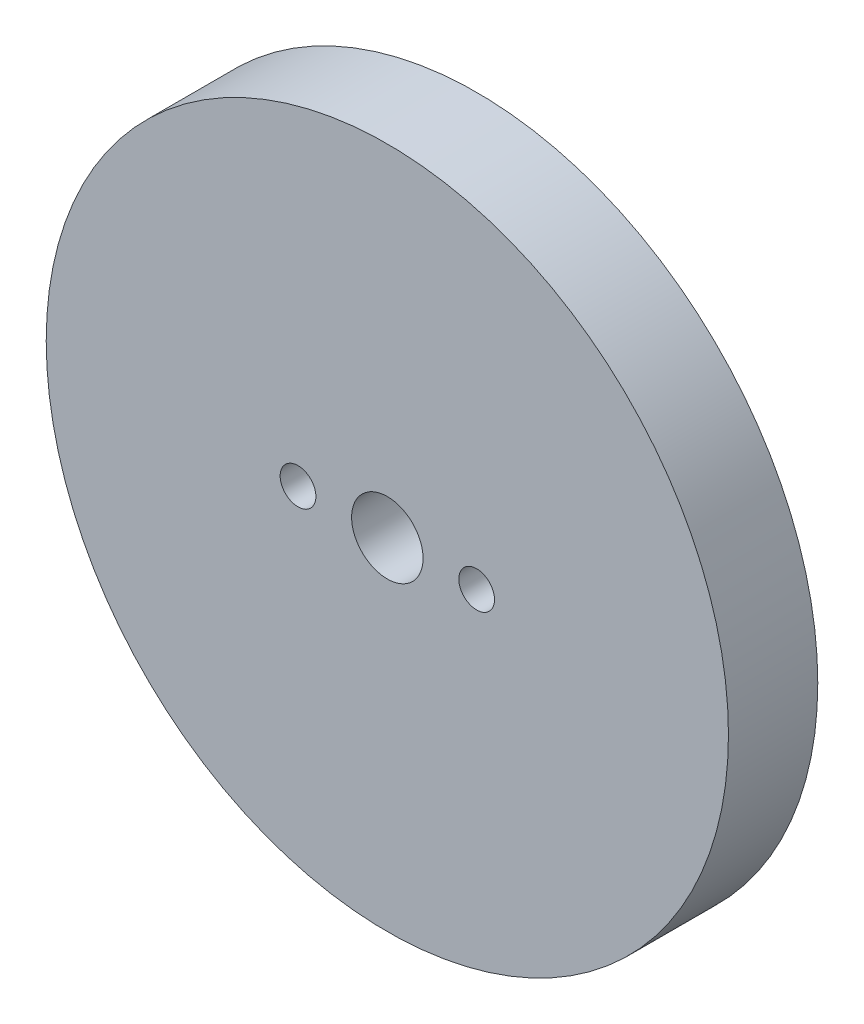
SolidWorks part; units mm, degrees
ref_plane "Front Plane" through (0, 0, 0) normal (0, 0, 1) x (1, 0, 0)
ref_plane "Top Plane" through (0, 0, 0) normal (0, 1, 0) x (1, 0, 0)
ref_plane "Right Plane" through (0, 0, 0) normal (1, 0, 0) x (0, 0, -1)
sketch "Sketch1" plane through (0, 0, 0) normal (0, 0, 1) x (1, 0, 0)
  circle A0 centre (0, 0) radius 19.095
extrude "Boss-Extrude1" add sketch "Sketch1" along normal blind 5
sketch "Sketch2" plane through (0, 0, 5) normal (0, 0, 1) x (1, 0, 0)
  circle A0 centre (0, 0) radius 2
  circle A1 centre (5, 0) radius 1
  circle A2 centre (-5, 0) radius 1
  dimension "D1" = 5
  dimension "D2" = 5
extrude "Cut-Extrude1" cut sketch "Sketch2" against normal blind 5
